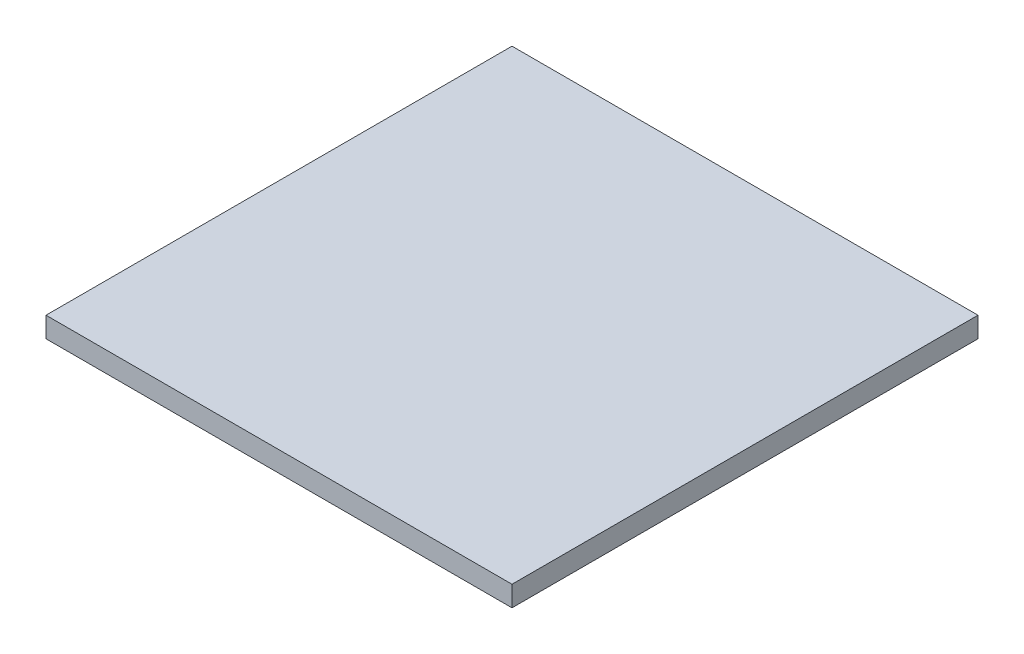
SolidWorks part; units mm, degrees
ref_plane "Front Plane" through (0, 0, 0) normal (0, 0, 1) x (1, 0, 0)
ref_plane "Top Plane" through (0, 0, 0) normal (0, 1, 0) x (1, 0, 0)
ref_plane "Right Plane" through (0, 0, 0) normal (1, 0, 0) x (0, 0, -1)
sketch "Sketch1" plane through (0, 0, 0) normal (0, 1, 0) x (1, 0, 0)
  line L1 (-57, 57) -> (57, 57)
  line L2 (-57, 57) -> (-57, -57)
  line L3 (-57, -57) -> (57, -57)
  line L4 (57, 57) -> (57, -57)
  line L5 (-57, 57) -> (57, -57) construction
  line L6 (-57, -57) -> (57, 57) construction
  point P0 (0, 0)
  dimension "D1" = 114
  dimension "D2" = 114
extrude "Boss-Extrude1" add sketch "Sketch1" along normal blind 5
